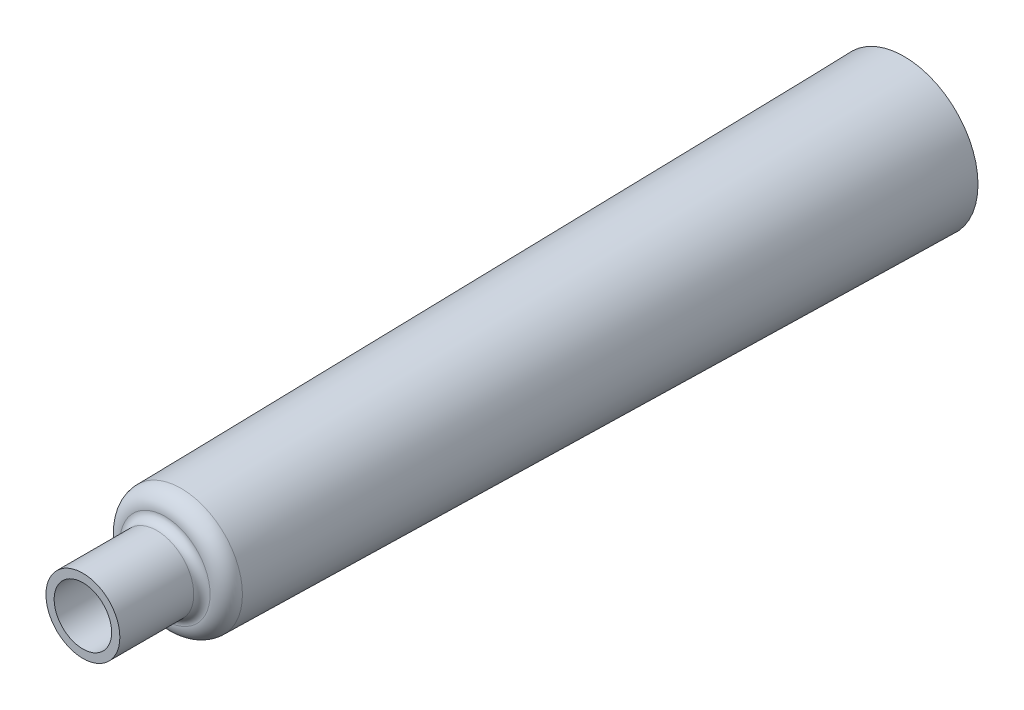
SolidWorks part; units mm, degrees
ref_plane "Plane1" through (0, 0, 0) normal (0, 0, 1) x (1, 0, 0)
ref_plane "Plane2" through (0, 0, 0) normal (0, 1, 0) x (1, 0, 0)
ref_plane "Plane3" through (0, 0, 0) normal (1, 0, 0) x (0, 0, -1)
sketch "Sketch1" plane through (0, 0, 0) normal (0, 0, 1) x (1, 0, 0)
  circle A0 centre (0, 0) radius 9
  dimension "D1" = 18
extrude "Base-Extrude" add sketch "Sketch1" along normal blind 90 draft 1
sketch "Sketch2" plane through (0, 0, 90) normal (0, 0, 1) x (1, 0, 0)
  circle A0 centre (0, 0) radius 4.5
  dimension "D1" = 9
extrude "Boss-Extrude1" add sketch "Sketch2" along normal blind 10
fillet "Fillet1" radius 2 1 edges at (7.429, 0, 90)
fillet "Fillet2" radius 1 2 edges at (4.5, 0, 90) (5.4636, 0, 90)
shell "Shell1" thickness 1
